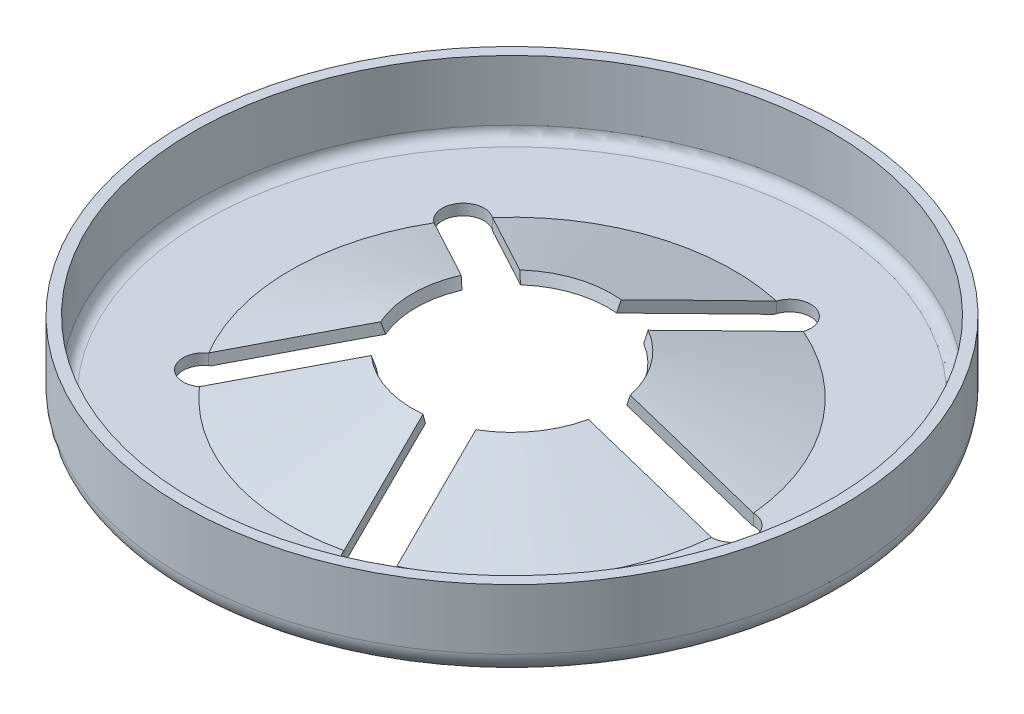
SolidWorks part; units mm, degrees
ref_plane "Plan1" through (0, 0, 0) normal (0, 0, 1) x (1, 0, 0)
ref_plane "Plan2" through (0, 0, 0) normal (0, 1, 0) x (1, 0, 0)
ref_plane "Plan3" through (0, 0, 0) normal (1, 0, 0) x (0, 0, -1)
sketch "Esquisse1" plane through (0, 0, 0) normal (0, 0, 1) x (1, 0, 0)
  line L0 (0, 0) -> (0, 40.2799) construction
  line L1 (4, 0.0349) -> (5.5999, 0.0349)
  line L2 (5.9999, 0.4349) -> (5.9999, 1.5349)
  line L5 (4, 0.0349) -> (1.75, 0.7849)
  arc A0 (5.9999, 0.4349) -> (5.5999, 0.0349) centre (5.5999, 0.4349) cw
  point P8 (5.9999, 0.0349)
  dimension "D6" = 0.4
  dimension "D1" = 1.5
  dimension "D2" = 6
  dimension "D3" = 1.75
  dimension "D4" = 4
  dimension "D5" = 0.75
revolve "Base-Révol.-Mince" add sketch "Esquisse1" angle 360 about L0
sketch "Esquisse2" plane through (0, 0.0349, 0) normal (0, -1, 0) x (1, 0, 0)
  line L0 (0, 0) -> (5.0745, 0) construction
  line L1 (4.0132, -0.3814) -> (1.2603, -0.3814)
  line L2 (4.0132, 0.3814) -> (1.2603, 0.3814)
  line L3 (1.2603, 0.3814) -> (1.2603, -0.3814)
  arc A0 (4.0132, -0.3814) -> (4.0132, 0.3814) centre (4.0132, 0) ccw
extrude "Enlèv. mat.-Extru.1" cut sketch "Esquisse2" against normal through all
pattern_circular "Répétition circulaire1" count 5 every 72 about axis through (0, 0, 0) along (0, 1, 0)
